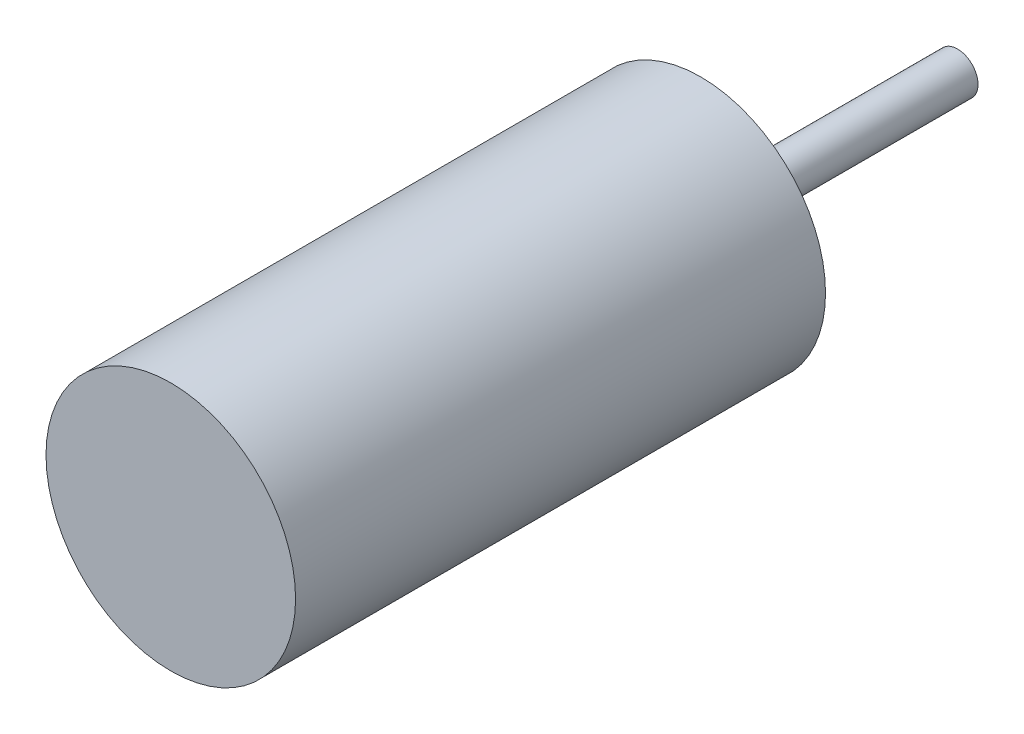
SolidWorks part; units mm, degrees
ref_plane "Front Plane" through (0, 0, 0) normal (0, 0, 1) x (1, 0, 0)
ref_plane "Top Plane" through (0, 0, 0) normal (0, 1, 0) x (1, 0, 0)
ref_plane "Right Plane" through (0, 0, 0) normal (1, 0, 0) x (0, 0, -1)
sketch "Sketch1" plane through (0, 0, 0) normal (0, 0, 1) x (1, 0, 0)
  circle A0 centre (0, 0) radius 12.15
  dimension "D1" = 24.3
extrude "Boss-Extrude1" add sketch "Sketch1" along normal blind 51.6
sketch "Sketch2" plane through (0, 0, 0) normal (0, 0, -1) x (-1, 0, 0)
  circle A0 centre (0, 0) radius 3.5
  dimension "D1" = 7
extrude "Boss-Extrude2" add sketch "Sketch2" along normal blind 2.4
sketch "Sketch3" plane through (0, 0, -2.4) normal (0, 0, -1) x (-1, 0, 0)
  circle A0 centre (0, 0) radius 2
  dimension "D1" = 4
extrude "Boss-Extrude3" add sketch "Sketch3" along normal blind 22.6
